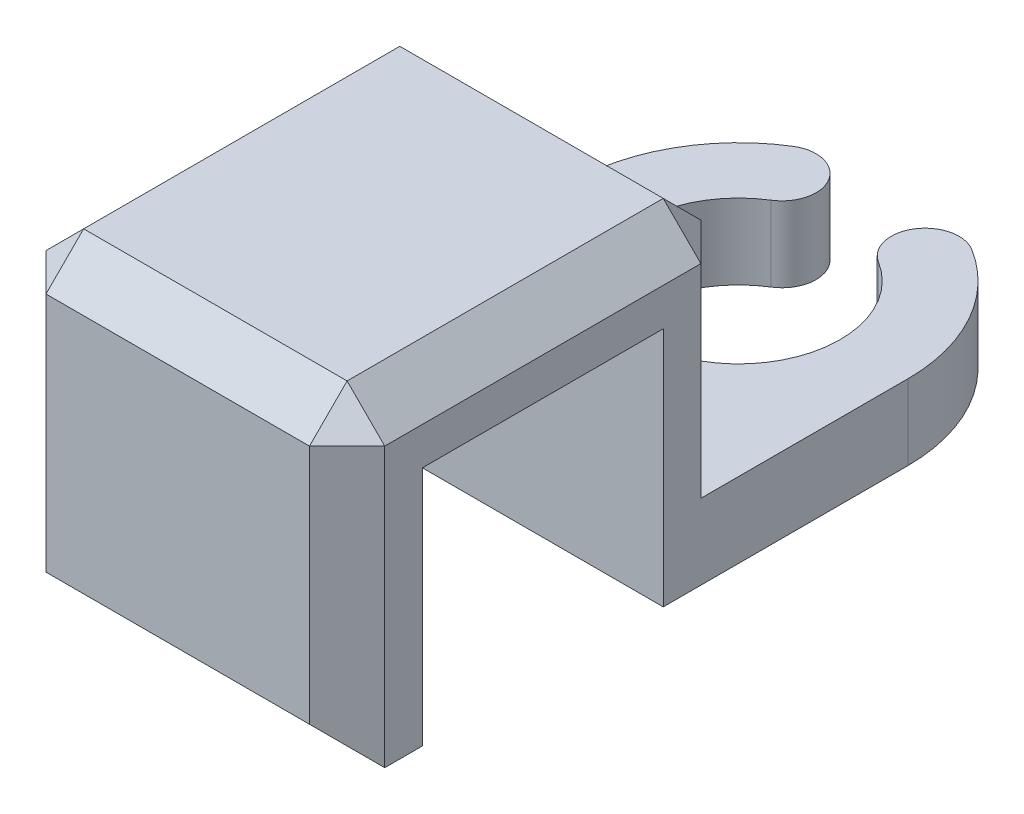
SolidWorks part; units mm, degrees
ref_plane "Спереди" through (0, 0, 0) normal (0, 0, 1) x (1, 0, 0)
ref_plane "Сверху" through (0, 0, 0) normal (0, 1, 0) x (1, 0, 0)
ref_plane "Справа" through (0, 0, 0) normal (1, 0, 0) x (0, 0, -1)
sketch "Эскиз1" plane through (0, 0, 0) normal (0, 1, 0) x (1, 0, 0)
  line L2 (22.5, 0) -> (22.5, -22.5)
  line L3 (22.5, -22.5) -> (-22.5, -22.5)
  line L4 (-22.5, 0) -> (-22.5, -22.5)
  arc A0 (-7.125, 11.4667) -> (7.125, 11.4667) centre (0, 0) ccw
  arc A1 (-11.875, 19.1111) -> (-22.5, 0) centre (0, 0) ccw
  arc A2 (22.5, 0) -> (11.875, 19.1111) centre (0, 0) ccw
  arc A3 (-7.125, 11.4667) -> (-11.875, 19.1111) centre (-9.5, 15.2889) ccw
  arc A4 (11.875, 19.1111) -> (7.125, 11.4667) centre (9.5, 15.2889) ccw
  dimension "D1" = 27
  dimension "D7" = 22.5
  dimension "D2" = 45
  dimension "D3" = 22.5
  dimension "D4" = 19
  dimension "D6" = 22.5
extrude "Бобышка-Вытянуть1" add sketch "Эскиз1" along normal blind 10
sketch "Эскиз3" plane through (22.5, 0, 0) normal (1, 0, 0) x (0, 0, -1)
  line L0 (-22.5, 0) -> (-22.5, 42)
  line L1 (-22.5, 42) -> (-74.5, 42)
  line L2 (-74.5, 42) -> (-74.5, 0)
  line L3 (-74.5, 0) -> (-64.5, 0)
  line L4 (-64.5, 0) -> (-64.5, 32)
  line L5 (-64.5, 32) -> (-32.5, 32)
  line L6 (-32.5, 32) -> (-32.5, 0)
  line L7 (-32.5, 0) -> (-22.5, 0)
  dimension "D1" = 10
  dimension "D2" = 32
  dimension "D3" = 32
  dimension "D4" = 10
  dimension "D5" = 10
extrude "Бобышка-Вытянуть2" add sketch "Эскиз3" against normal blind 45
chamfer "Фаска1" distance 5 angle 45 9 edges at (0, 0, 74.5) (22.5, 21, 74.5) (-22.5, 21, 74.5) (0, 42, 74.5) (22.5, 42, 48.5) (-22.5, 42, 48.5) (0, 42, 22.5)
